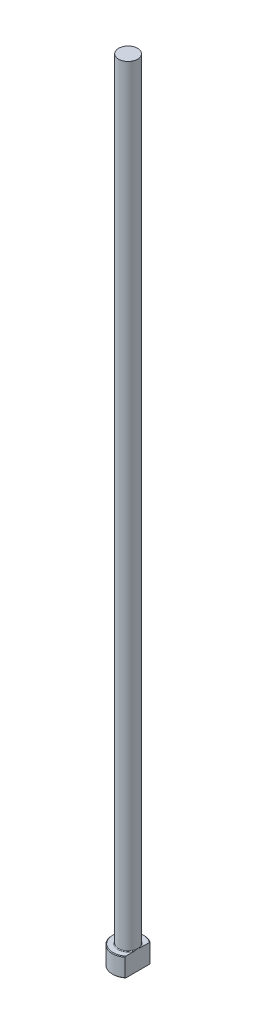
SolidWorks part; units mm, degrees
ref_plane "Front Plane" through (0, 0, 0) normal (0, 0, 1) x (1, 0, 0)
ref_plane "Top Plane" through (0, 0, 0) normal (0, 1, 0) x (1, 0, 0)
ref_plane "Right Plane" through (0, 0, 0) normal (1, 0, 0) x (0, 0, -1)
sketch "Sketch1" plane through (0, 0, 0) normal (0, 0, 1) x (1, 0, 0)
  line L0 (0, 259.9588) -> (0, -15.1925) construction
  line L1 (0, 0) -> (-5, 0)
  line L2 (-5, 0) -> (-5, 6)
  line L3 (-5, 6) -> (-3, 6)
  line L4 (-3, 6) -> (-3, 250)
  line L5 (-3, 250) -> (0, 250)
  line L6 (0, 250) -> (0, 0)
  dimension "L" = 250
  dimension "H" = 10
  dimension "T" = 6
  dimension "D" = 6
revolve "Revolve1" add sketch "Sketch1" angle 360 about L0
chamfer "Chamfer1" distance 0.2 angle 45 2 edges at (0, 6, 5) (0, 0, 5)
fillet "Fillet1" radius 0.2 1 edges at (0, 6, 3)
sketch "Sketch2" plane through (0, 0, 0) normal (0, 1, 0) x (1, 0, 0)
  line L0 (3, -4) -> (3, 4)
  circle A0 centre (0, 0) radius 5 construction
  arc A1 (3, -4) -> (3, 4) centre (0, 0) ccw
  circle A2 centre (0, 0) radius 3 construction
extrude "KEYED HEAD" cut sketch "Sketch2" along normal through all
